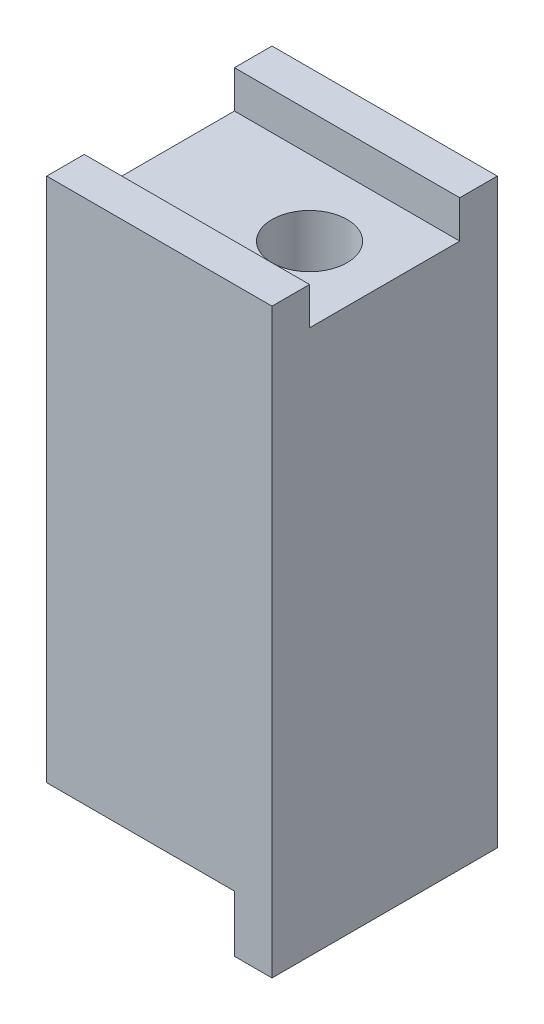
SolidWorks part; units mm, degrees
ref_plane "Front Plane" through (0, 0, 0) normal (0, 0, 1) x (1, 0, 0)
ref_plane "Top Plane" through (0, 0, 0) normal (0, 1, 0) x (1, 0, 0)
ref_plane "Right Plane" through (0, 0, 0) normal (1, 0, 0) x (0, 0, -1)
sketch "Sketch1" plane through (0, 0, 0) normal (0, 0, 1) x (1, 0, 0)
  line L0 (0, 0) -> (9.525, 0)
  line L1 (9.525, 0) -> (9.525, -49.1998)
  line L2 (9.525, -49.1998) -> (-9.525, -49.1998)
  line L3 (-9.525, -49.1998) -> (-9.525, 0)
  line L4 (-9.525, 0) -> (0, 0)
  line L5 (0, 0) -> (0, -21.2516) construction
  line L6 (-9.525, -3.175) -> (9.525, -3.175)
  line L7 (3.175, 0) -> (3.175, -3.175) construction
  line L8 (-3.175, -49.1998) -> (-3.175, -44.4246) construction
  line L9 (6.35, -49.1998) -> (6.35, -44.4246)
  line L10 (6.35, -44.4246) -> (-9.525, -44.4246)
  dimension "D1" = 19.05
  dimension "D2" = 3.175
  dimension "D3" = 6.35
  dimension "D4" = 6.35
  dimension "D5" = 49.1998
  dimension "D6" = 4.7752
  dimension "D7" = 3.175
sketch "Sketch2" plane through (0, 0, 0) normal (0, 0, 1) x (1, 0, 0)
  line L0 (9.525, -49.1998) -> (-9.525, -49.1998) construction
  line L1 (9.525, 0) -> (9.525, -49.1998) construction
  line L2 (6.35, -49.1998) -> (6.35, -44.4246) construction
  line L3 (6.35, -44.4246) -> (-9.525, -44.4246) construction
  line L4 (-9.525, -49.1998) -> (-9.525, 0) construction
  line L5 (-9.525, 0) -> (0, 0) construction
  line L6 (0, 0) -> (9.525, 0) construction
  line L7 (9.525, -49.1998) -> (6.35, -49.1998)
  line L8 (9.525, 0) -> (9.525, -49.1998)
  line L9 (6.35, -49.1998) -> (6.35, -44.4246)
  line L10 (6.35, -44.4246) -> (-9.525, -44.4246)
  line L11 (-9.525, -44.4246) -> (-9.525, 0)
  line L12 (-9.525, 0) -> (0, 0)
  line L13 (0, 0) -> (9.525, 0)
extrude "Boss-Extrude1" add sketch "Sketch2" along normal mid plane 19.05
sketch "Sketch3" plane through (0, 0, 0) normal (0, 0, 1) x (1, 0, 0)
  line L0 (-9.525, 0) -> (0, 0) construction
  line L1 (0, 0) -> (9.525, 0) construction
  line L2 (9.525, 0) -> (9.525, -49.1998) construction
  line L3 (-9.525, -3.175) -> (9.525, -3.175) construction
  line L4 (-9.525, -49.1998) -> (-9.525, 0) construction
  line L5 (-9.525, 0) -> (0, 0)
  line L6 (0, 0) -> (9.525, 0)
  line L7 (9.525, 0) -> (9.525, -3.175)
  line L8 (-9.525, -3.175) -> (9.525, -3.175)
  line L9 (-9.525, -3.175) -> (-9.525, 0)
extrude "Cut-Extrude1" cut sketch "Sketch3" against normal mid plane 12.7
hole_wizard "1/4-20 Tapped Hole1" positions "Sketch5" profile "Sketch4" tap size "1/4-20" standard "ANSI Inch"
sketch "Sketch5" plane through (0, -3.175, 0) normal (0, 1, 0) x (1, 0, 0)
  point P0 (3.175, 0)
sketch "Sketch4" plane through (3.175, -3.175, 0) normal (1, 0, 0) x (0, 0, 1)
  line L0 (0, 0) -> (0, 18.0438)
  line L1 (0, 18.0438) -> (2.5527, 16.51)
  line L2 (2.5527, 16.51) -> (2.5527, 12.7)
  line L3 (2.5527, 12.7) -> (3.175, 12.7)
  line L4 (3.175, 12.7) -> (3.175, 0)
  line L5 (3.175, 0) -> (0, 0)
  line L10 (0, 18.0438) -> (-2.5527, 16.51) construction
  line L11 (0, -6.35) -> (0, 107.95) construction
  dimension "Tap Drill Dia." = 5.1054
  dimension "Tap Drill Depth" = 16.51
  dimension "Thread Major Dia." = 6.35
  dimension "Thread Depth" = 12.7
  dimension "Drill Angle" = 118
hole_wizard "1/4-20 Tapped Hole2" positions "Sketch7" profile "Sketch6" tap size "1/4-20" standard "ANSI Inch"
sketch "Sketch7" plane through (0, -44.4246, 0) normal (0, -1, 0) x (-1, 0, 0)
  point P0 (3.175, 0)
sketch "Sketch6" plane through (-3.175, -44.4246, 0) normal (1, 0, 0) x (0, 0, -1)
  line L0 (0, 0) -> (0, 18.0438)
  line L1 (0, 18.0438) -> (2.5527, 16.51)
  line L2 (2.5527, 16.51) -> (2.5527, 12.7)
  line L3 (2.5527, 12.7) -> (3.175, 12.7)
  line L4 (3.175, 12.7) -> (3.175, 0)
  line L5 (3.175, 0) -> (0, 0)
  line L10 (0, 18.0438) -> (-2.5527, 16.51) construction
  line L11 (0, -6.35) -> (0, 107.95) construction
  dimension "Tap Drill Dia." = 5.1054
  dimension "Tap Drill Depth" = 16.51
  dimension "Thread Major Dia." = 6.35
  dimension "Thread Depth" = 12.7
  dimension "Drill Angle" = 118
